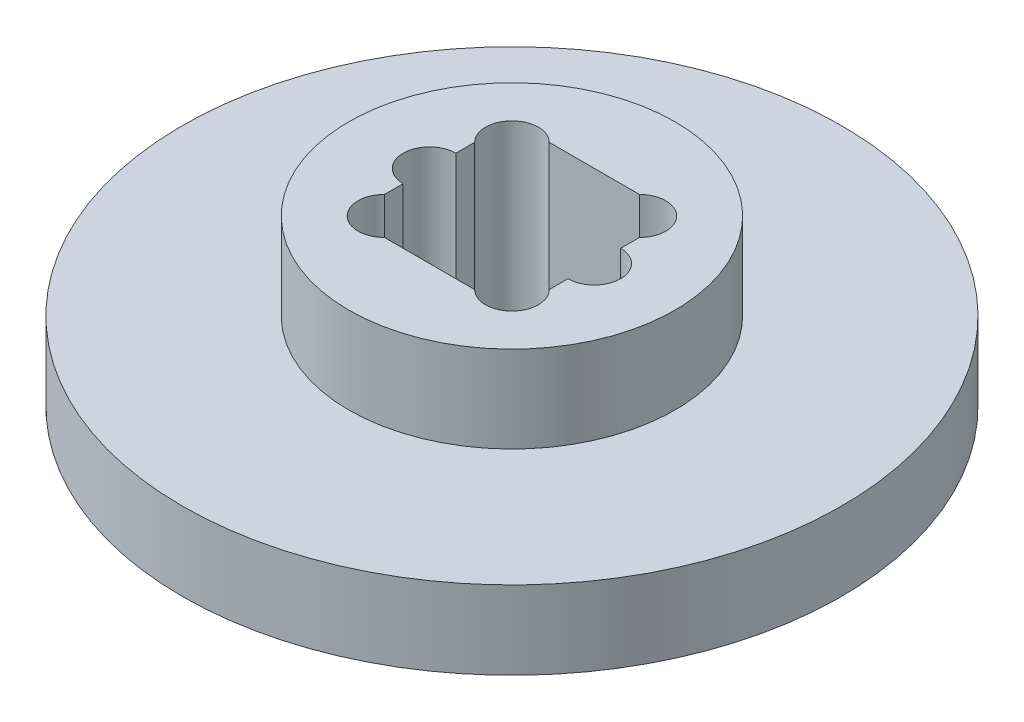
SolidWorks part; units mm, degrees
ref_plane "Plan de face" through (0, 0, 0) normal (0, 0, 1) x (1, 0, 0)
ref_plane "Plan de dessus" through (0, 0, 0) normal (0, 1, 0) x (1, 0, 0)
ref_plane "Plan de droite" through (0, 0, 0) normal (1, 0, 0) x (0, 0, -1)
sketch "Esquisse1" plane through (0, 0, 0) normal (0, 1, 0) x (1, 0, 0)
  circle A0 centre (0, 0) radius 20
extrude "Boss.-Extru.1" add sketch "Esquisse1" along normal blind 4.75
sketch "Esquisse2" plane through (0, 4.75, 0) normal (0, 1, 0) x (1, 0, 0)
  circle A0 centre (0, 0) radius 9.9
extrude "Boss.-Extru.2" add sketch "Esquisse2" along normal blind 5.25
sketch "Esquisse3" plane through (0, 10, 0) normal (0, 1, 0) x (1, 0, 0)
  line L0 (0, -5.05) -> (0, 9.9) construction
  line L1 (-5, 0) -> (8.3606, 0) construction
  line L2 (-2.7373, 5) -> (2.7373, 5)
  line L3 (-5, 2.7373) -> (-5, -2.7373)
  line L4 (-2.7373, -5) -> (2.7373, -5)
  line L5 (5, 2.7373) -> (5, -2.7373)
  line L6 (-5, 5) -> (5, -5) construction
  line L7 (-5, -5) -> (5, 5) construction
  arc A0 (-2.7373, 5) -> (-5, 2.7373) centre (-3.8686, 3.8686) ccw
  circle A1 centre (0, 0) radius 9.9 construction
  arc A2 (2.7373, 5) -> (5, 2.7373) centre (3.8686, 3.8686) cw
  arc A3 (2.7373, -5) -> (5, -2.7373) centre (3.8686, -3.8686) ccw
  arc A4 (-2.7373, -5) -> (-5, -2.7373) centre (-3.8686, -3.8686) cw
  point P0 (0, 0)
  point P8 (-3.8686, 3.8686)
  dimension "D3" = 1.6
  dimension "D1" = 10
  dimension "D2" = 10
extrude "Enlèv. mat.-Extru.1" cut sketch "Esquisse3" against normal through all
sketch "Esquisse4" plane through (0, 0, 0) normal (0, -1, 0) x (-1, 0, 0)
  circle A0 centre (5, 0) radius 1.6
  circle A1 centre (-5, 0) radius 1.6
  dimension "D1" = 5
extrude "Enlèv. mat.-Extru.2" cut sketch "Esquisse4" against normal blind 10
